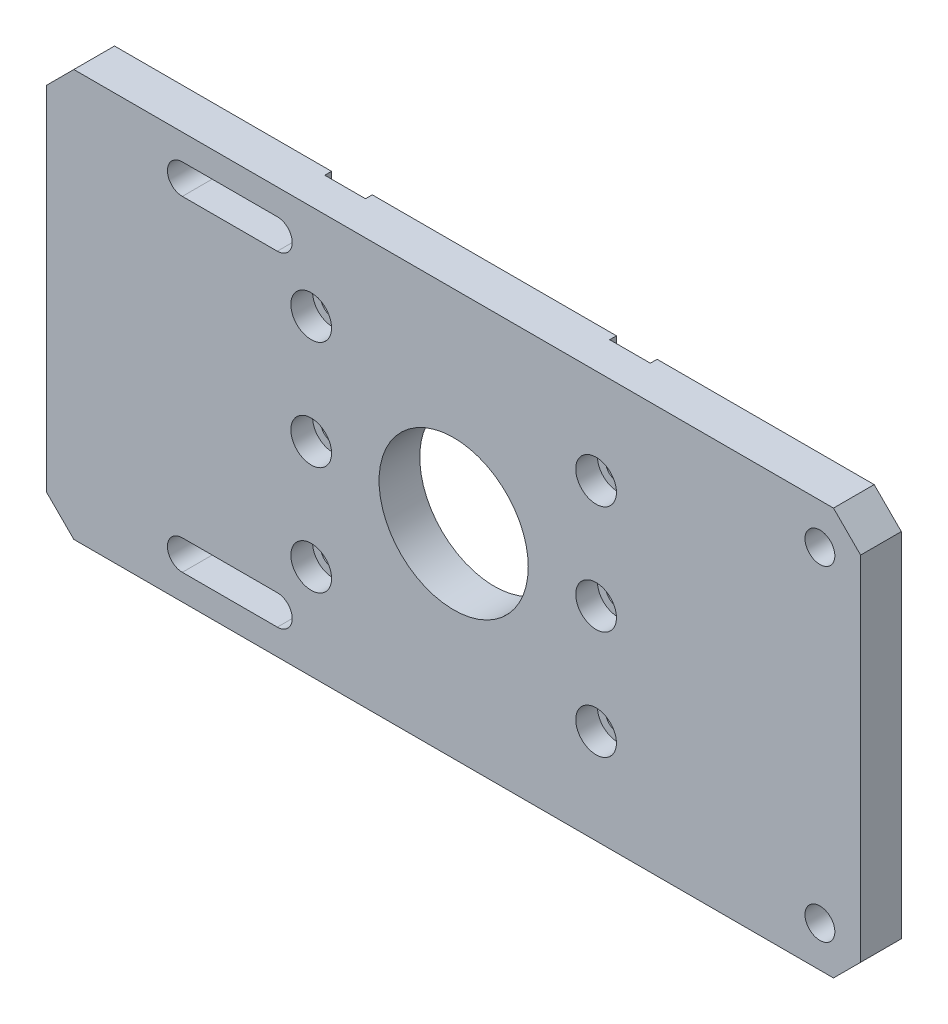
SolidWorks part; units mm, degrees
ref_plane "Face" through (0, 0, 0) normal (0, 0, 1) x (1, 0, 0)
ref_plane "Dessus" through (0, 0, 0) normal (0, 1, 0) x (1, 0, 0)
ref_plane "Droite" through (0, 0, 0) normal (1, 0, 0) x (0, 0, -1)
sketch "Esquisse1" plane through (0, 0, 0) normal (0, 0, 1) x (1, 0, 0)
  line L0 (140, 75) -> (150, 65)
  line L1 (-140, 75) -> (140, 75)
  line L2 (-150, 65) -> (-150, -65)
  line L3 (-140, -75) -> (140, -75)
  line L4 (150, 65) -> (150, -65)
  line L5 (140, -75) -> (150, -65)
  line L6 (-150, -65) -> (-140, -75)
  line L7 (-150, 65) -> (-140, 75)
  circle A0 centre (0, 0) radius 27.5
  point P0 (-150, 75)
  point P1 (150, -75)
  point P2 (-150, -75)
  point P3 (150, 75)
  dimension "D5" = 55
  dimension "D1" = 75
  dimension "D2" = 75
  dimension "D3" = 150
  dimension "D4" = 150
extrude "Extrusion1" add sketch "Esquisse1" along normal blind 15
sketch "Esquisse2" plane through (0, 0, 15) normal (0, 0, 1) x (1, 0, 0)
  line L0 (140, 75) -> (-140, 75) construction
  line L1 (150, -65) -> (150, 65) construction
  line L2 (-140, -75) -> (140, -75) construction
  line L3 (-65, -54.5) -> (-100, -54.5)
  line L4 (-100, 65.5) -> (-65, 65.5)
  line L5 (-150, 65) -> (-150, -65) construction
  line L6 (-65, 54.5) -> (-100, 54.5)
  line L7 (0, 0) -> (-171.8549, 0) construction
  line L8 (-100, -65.5) -> (-65, -65.5)
  circle A0 centre (135, 60) radius 5.5
  circle A1 centre (135, -60) radius 5.5
  arc A2 (-100, 65.5) -> (-100, 54.5) centre (-100, 60) ccw
  arc A3 (-65, 54.5) -> (-65, 65.5) centre (-65, 60) ccw
  arc A4 (-65, -54.5) -> (-65, -65.5) centre (-65, -60) cw
  arc A5 (-100, -65.5) -> (-100, -54.5) centre (-100, -60) cw
  dimension "D1" = 11
  dimension "D2" = 11
  dimension "D3" = 15
  dimension "D4" = 15
  dimension "D6" = 15
  dimension "D7" = 11
  dimension "D8" = 11
  dimension "D10" = 15
  dimension "D5" = 15
  dimension "D9" = 35
  dimension "D11" = 50
extrude "Enlèv. mat.-Extru.1" cut sketch "Esquisse2" against normal through all
hole_wizard "Chambrage pour vis à tête cylindrique à 6 pans creux (ou vis CHC) M81" positions "Esquisse4" profile "Esquisse3" counterbore size "M8" standard "Ansi Métrique"
sketch "Esquisse4" plane through (0, 0, 15) normal (0, 0, 1) x (1, 0, 0)
  line L0 (52.5, 40) -> (-52.5, 40) construction
  line L1 (52.5, 40) -> (52.5, 0) construction
  point P0 (52.5, 40)
  point P4 (-52.5, 40)
  point P5 (52.5, 0)
  point P6 (-52.5, 0)
  point P7 (52.5, -40)
  point P8 (-52.5, -40)
  dimension "D1" = 52.5
  dimension "D2" = 40
  dimension "D3" = 90
  dimension "D4" = 52.5
sketch "Esquisse3" plane through (52.5, 40, 15) normal (1, 0, 0) x (0, -1, 0)
  line L0 (0, 0) -> (0, 15)
  line L1 (0, 15) -> (4.5, 15)
  line L3 (4.5, 15) -> (4.5, 8)
  line L4 (4.5, 8) -> (7.5, 8)
  line L5 (7.5, 8) -> (7.5, 0)
  line L7 (7.5, 0) -> (0, 0)
  line L11 (0, -6.35) -> (0, 107.95) construction
  dimension "Diamètre du perçage jusqu'au prochain" = 9
  dimension "Profondeur du perçage jusqu'au prochain" = 15
  dimension "Diamètre du chambrage" = 15
  dimension "Profondeur du chambrage" = 8
sketch "Esquisse5" plane through (0, 0, 0) normal (0, 1, 0) x (1, 0, 0)
  line L0 (-140, 0) -> (140, 0) construction
  line L1 (-60, -2.5) -> (-45, -2.5)
  line L2 (-60, -2.5) -> (-60, 7.5)
  line L3 (-60, 7.5) -> (-45, 7.5)
  line L4 (-45, -2.5) -> (-45, 7.5)
  line L5 (45, -2.5) -> (60, -2.5)
  line L6 (45, -2.5) -> (45, 7.5)
  line L7 (45, 7.5) -> (60, 7.5)
  line L8 (60, -2.5) -> (60, 7.5)
  dimension "D1" = 2.5
  dimension "D2" = 2.5
  dimension "D3" = 45
  dimension "D4" = 45
  dimension "D5" = 15
  dimension "D6" = 15
  dimension "D7" = 10
  dimension "D8" = 10
extrude "Enlèv. mat.-Extru.2" cut sketch "Esquisse5" against normal through all and the other way through all
